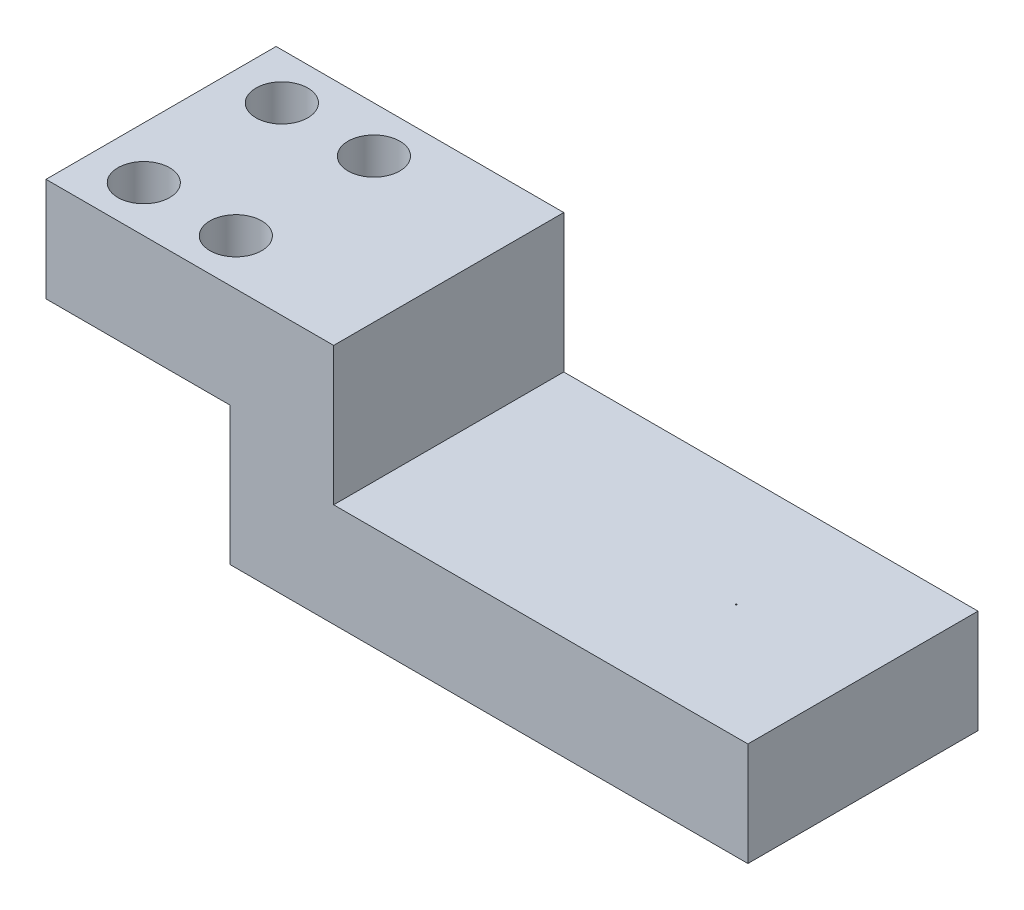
SolidWorks part; units mm, degrees
ref_plane "Face" through (0, 0, 0) normal (0, 0, 1) x (1, 0, 0)
ref_plane "Dessus" through (0, 0, 0) normal (0, 1, 0) x (1, 0, 0)
ref_plane "Droite" through (0, 0, 0) normal (1, 0, 0) x (0, 0, -1)
sketch "Esquisse1" plane through (0, 0, 0) normal (0, 0, 1) x (1, 0, 0)
  line L0 (0, 0) -> (25, 0)
  line L1 (25, 0) -> (25, -12)
  line L2 (25, -12) -> (61, -12)
  line L3 (61, -12) -> (61, -21)
  line L4 (61, -21) -> (16, -21)
  line L5 (16, -21) -> (16, -9)
  line L6 (16, -9) -> (0, -9)
  line L7 (0, -9) -> (0, 0)
  dimension "D1" = 12
  dimension "D2" = 25
  dimension "D3" = 16
  dimension "D4" = 9
  dimension "D5" = 9
  dimension "D6" = 45
extrude "Base-Extrusion" add sketch "Esquisse1" along normal mid plane 20
sketch "Esquisse2" plane through (0, 0, 0) normal (0, 1, 0) x (-1, 0, 0)
  line L0 (0, 10) -> (0, -10) construction
  line L1 (-25, -10) -> (0, -10) construction
  line L2 (-4.5, -6) -> (-12.5, -6) construction
  line L3 (-4.5, -6) -> (-4.5, 6) construction
  circle A0 centre (-4.5, -6) radius 2.25
  circle A1 centre (-12.5, -6) radius 2.25
  circle A2 centre (-4.5, 6) radius 2.25
  circle A3 centre (-12.5, 6) radius 2.25
  dimension "D1" = 4.5
  dimension "D2" = 4.5
  dimension "D3" = 4
  dimension "D4" = 90
extrude "Enlèv. mat.-Extru.1" cut sketch "Esquisse2" against normal through all
sketch "Esquisse3" plane through (0, -12, 0) normal (0, 1, 0) x (-1, 0, 0)
  line L0 (-25, 10) -> (-25, -10) construction
  line L1 (-61, -10) -> (-25, -10) construction
  circle A0 centre (-50, 0) radius 0.05
  dimension "D3" = 0.1
  dimension "D1" = 25
  dimension "D2" = 10
extrude "Enlèv. mat.-Extru.2" cut sketch "Esquisse3" against normal blind 0.1
